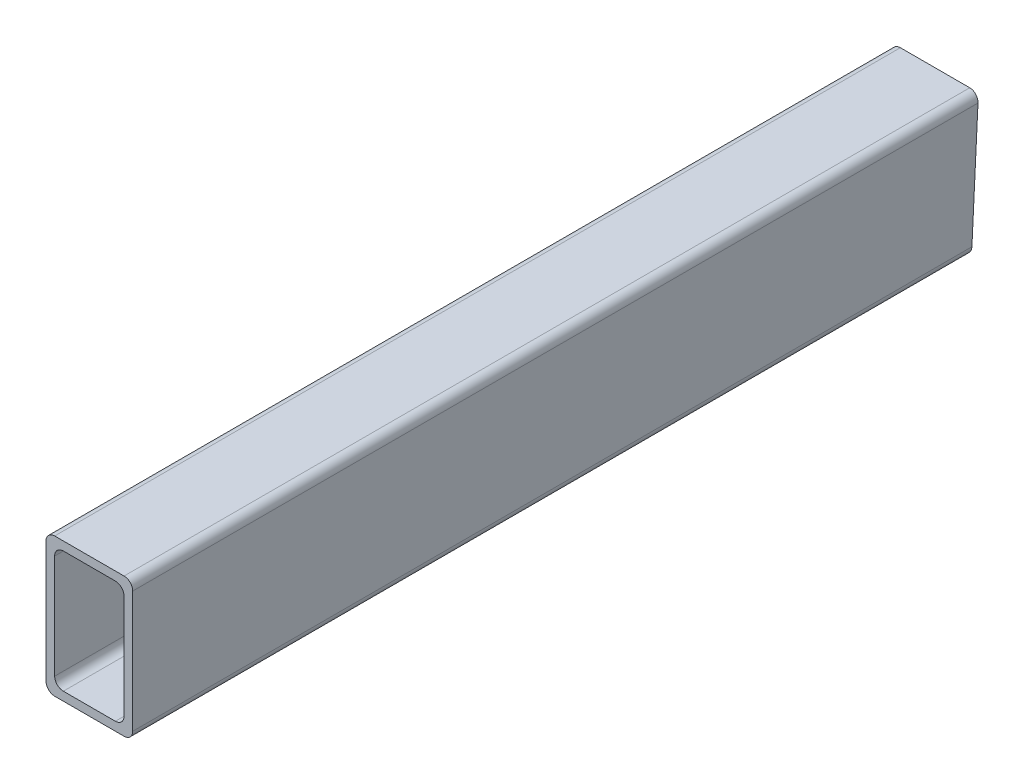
SolidWorks part; units mm, degrees
ref_plane "Plan de face" through (0, 0, 0) normal (0, 0, 1) x (1, 0, 0)
ref_plane "Plan de dessus" through (0, 0, 0) normal (0, 1, 0) x (1, 0, 0)
ref_plane "Plan de droite" through (0, 0, 0) normal (1, 0, 0) x (0, 0, -1)
sketch "Esquisse1" plane through (0, 0, 0) normal (0, 0, 1) x (1, 0, 0)
  line L1 (-25, 40) -> (25, 40)
  line L2 (-25, 40) -> (-25, -40)
  line L3 (-25, -40) -> (25, -40)
  line L4 (25, 40) -> (25, -40)
  line L5 (-20, 35) -> (20, 35)
  line L6 (-20, 35) -> (-20, -35)
  line L7 (-20, -35) -> (20, -35)
  line L8 (20, 35) -> (20, -35)
  dimension "D1" = 50
  dimension "D2" = 25
  dimension "D3" = 80
  dimension "D4" = 5
  dimension "D5" = 40
  dimension "D6" = 5
  dimension "D7" = 5
  dimension "D8" = 5
extrude "Boss.-Extru.1" add sketch "Esquisse1" along normal blind 10500
fillet "Congé1" radius 5 8 edges at (25, -40, 5250) (20, -35, 5250) (-25, -40, 5250) (-20, -35, 5250) (20, 35, 5250) (25, 40, 5250) (-20, 35, 5250) (-25, 40, 5250)
sketch "Esquisse2" plane through (25, 0, 0) normal (1, 0, 0) x (0, 0, -1)
  line L0 (0, 40) -> (-4.6172, -52.3438)
  line L1 (0, 40) -> (68.986, 40)
  line L2 (68.986, 40) -> (68.986, -52.3438)
  line L3 (68.986, -52.3438) -> (-4.6172, -52.3438)
  line L4 (0, -35) -> (0, 35) construction
  dimension "D1" = 2.862
extrude "Enlèv. mat.-Extru.1" cut sketch "Esquisse2" against normal through all
sketch "Esquisse3" plane through (25, 0, 0) normal (1, 0, 0) x (0, 0, -1)
  line L0 (-10012.49, 4573.557) -> (-10012.49, -3875.3135) construction
  line L1 (-10012.49, 40) -> (-10016.9807, -49.8137)
  line L2 (-10500, 40) -> (0, 40) construction
  line L3 (-10016.9807, -49.8137) -> (-10604.2054, -49.8137)
  line L4 (-10604.2054, -49.8137) -> (-10604.2054, 165.4731)
  line L5 (-10604.2054, 173.3552) -> (-10012.49, 165.4731)
  line L6 (-10012.49, 165.4731) -> (-10012.49, 40)
  dimension "D1" = 10012.49
  dimension "D2" = 2.862
extrude "Enlèv. mat.-Extru.2" cut sketch "Esquisse3" against normal through all and the other way through all
